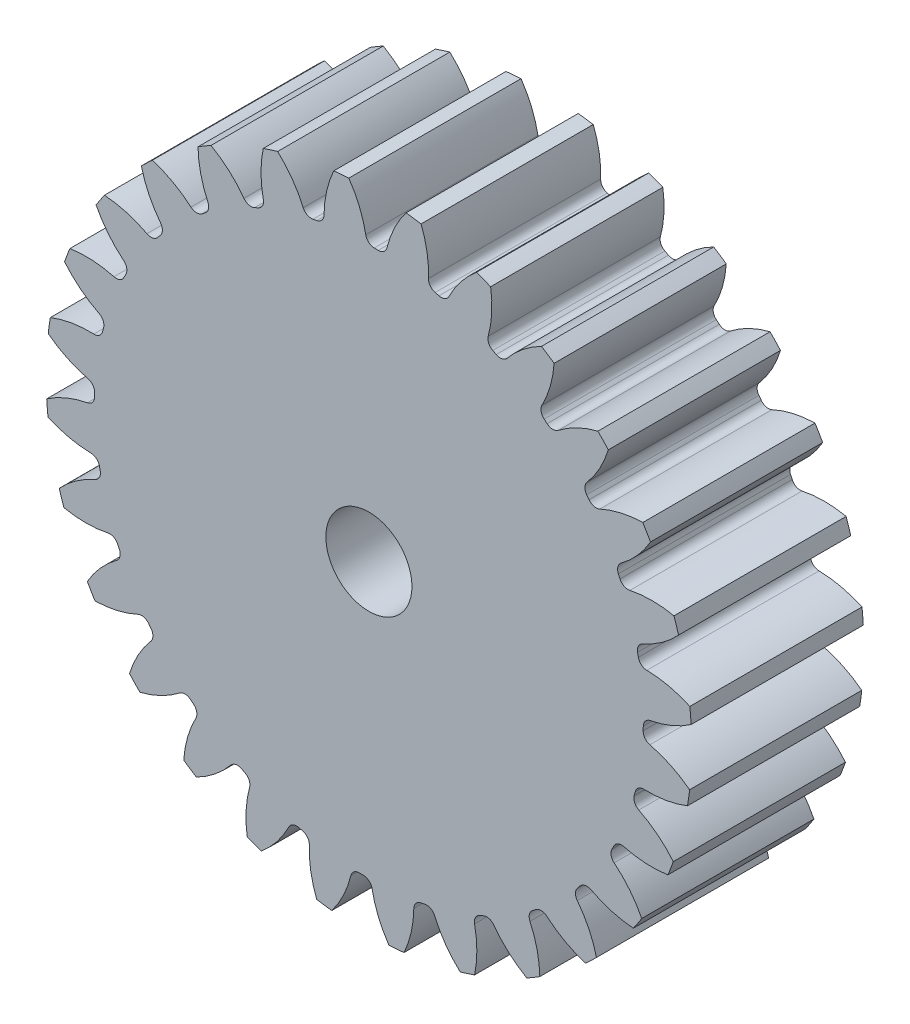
SolidWorks part; units mm, degrees
ref_plane "Front" through (0, 0, 0) normal (0, 0, 1) x (1, 0, 0)
ref_plane "Top" through (0, 0, 0) normal (0, 1, 0) x (1, 0, 0)
ref_plane "Right" through (0, 0, 0) normal (1, 0, 0) x (0, 0, -1)
sketch "Sketch3" plane through (0, 0, 0) normal (0, 0, 1) x (1, 0, 0)
  circle A0 centre (0, 0) radius 190.5
  dimension "od" = 381
extrude "gearBody" add sketch "Sketch3" along normal blind 101.6
sketch "Sketch2" plane through (0, 0, 0) normal (0, 0, 1) x (1, 0, 0)
  line L0 (0, 0) -> (154.3593, 63.9377) construction
  line L1 (189.5892, -22.1926) -> (0, 0) construction
  line L2 (0, 0) -> (36.3143, 0) construction
  line L3 (177.7234, 5.2198) -> (177.1956, -14.6474) construction
  line L5 (177.4595, -4.7138) -> (0, 0) construction
  line L7 (0, 0) -> (167.0773, 0) construction
  arc A0 (167.065, 2.0326) -> (166.7215, -10.8989) centre (0, 0) ccw construction
  arc A1 (190.1316, 11.8414) -> (189.2349, -21.9185) centre (0, 0) ccw construction
  arc A2 (177.7234, 5.2198) -> (177.1956, -14.6474) centre (0, 0) ccw construction
  arc A3 (161.8328, -5.4631) -> (161.8946, -3.136) centre (0, 0) ccw
  arc A4 (189.5892, -22.1926) -> (165.77, -10.6582) centre (150.7473, -72.0422) ccw
  arc A5 (189.5892, -22.1926) -> (190.5, 12.0963) centre (0, 0) ccw
  arc A6 (190.5, 12.0963) -> (166.1021, 1.8428) centre (154.3593, 63.9377) cw
  arc A7 (161.8946, -3.136) -> (166.1021, 1.8428) centre (167.0626, -3.2361) cw
  arc A8 (165.77, -10.6582) -> (161.8328, -5.4631) centre (166.9988, -5.6375) cw
  point P6 (190.5, 12.0963)
  point P22 (189.5892, -22.1926)
  dimension "baseDia" = 334.1547
  dimension "od" = 381
  dimension "pd" = 355.6
  dimension "rd" = 323.85
  dimension "rFillet" = 5.1689
  dimension "pointX" = 190.5
  dimension "pointY" = 12.0963
  dimension "CTT" = 19.8672
  dimension "flankCenterAngle" = 22.5
extrude "toothCut" cut sketch "Sketch2" along normal through all
pattern_circular "CirPattern1" count 28 over 360 about axis through (0, 0, 0) along (0, 0, 1) of "toothCut"
sketch "hub1Dia" plane through (0, 0, 0) normal (0, 0, -1) x (-1, 0, 0)
  circle A0 centre (0, 0) radius 12.7
  dimension "hub1Dia" = 25.4
sketch "hub2Dia" plane through (0, 0, 101.6) normal (0, 0, 1) x (1, 0, 0)
  circle A0 centre (0, 0) radius 12.7
  dimension "hub2dia" = 25.4
sketch "boreDia" plane through (0, 0, 0) normal (0, 0, 1) x (1, 0, 0)
  circle A0 centre (0, 0) radius 25.4
  dimension "boreDia" = 50.8
extrude "bore" cut sketch "boreDia" against normal mid plane 25400
